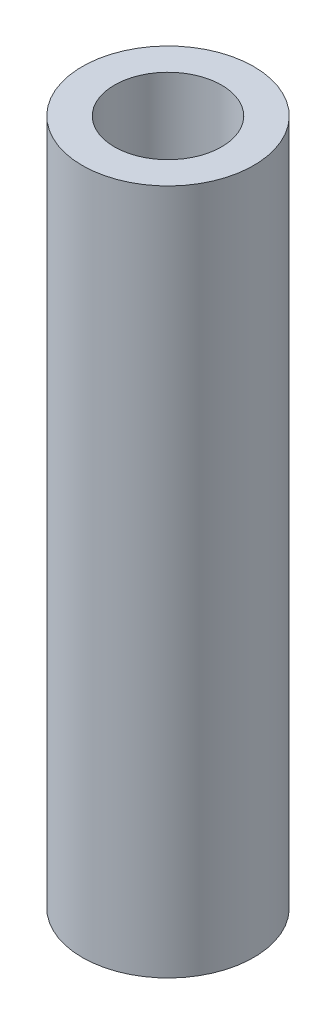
SolidWorks part; units mm, degrees
ref_plane "Front" through (0, 0, 0) normal (0, 0, 1) x (1, 0, 0)
ref_plane "Top" through (0, 0, 0) normal (0, 1, 0) x (1, 0, 0)
ref_plane "Right" through (0, 0, 0) normal (1, 0, 0) x (0, 0, -1)
sketch "Sketch1" plane through (0, 0, 0) normal (0, 1, 0) x (1, 0, 0)
  circle A0 centre (0, 0) radius 4
  circle A1 centre (0, 0) radius 2.5
extrude "Extrude1" add sketch "Sketch1" along normal blind 32
